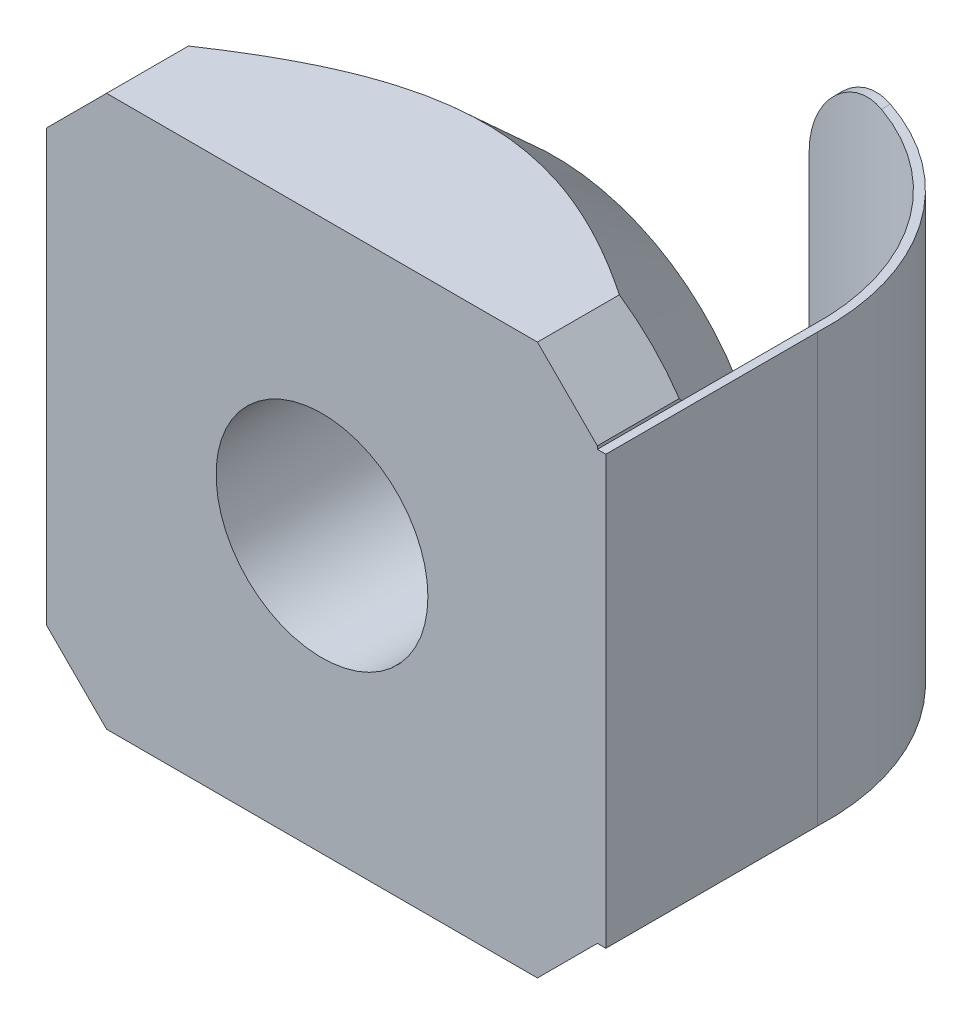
SolidWorks part; units mm, degrees
ref_plane "Front" through (0, 0, 0) normal (0, 0, 1) x (1, 0, 0)
ref_plane "Top" through (0, 0, 0) normal (0, 1, 0) x (1, 0, 0)
ref_plane "Right" through (0, 0, 0) normal (1, 0, 0) x (0, 0, -1)
imported_body "Imported1"
hole_wizard "M6x1.0 Tapped Hole1" positions "3DSketch1" profile "Sketch1" tap size "M6x1.0" standard "Ansi Metric"
sketch3d "3DSketch1"
  line L0 (-6.5, 5.0858, 0) -> (-6.5, -5.0858, 0) construction
  line L1 (5.0858, 6.5, 0) -> (-5.0858, 6.5, 0) construction
  point P0 (0, 0, 0)
  dimension "D1" = 6.5
  dimension "D2" = 6.5
sketch "Sketch1" plane through (0, 0, 0) normal (1, 0, 0) x (0, -1, 0)
  line L0 (0, 0) -> (0, 7.5022)
  line L1 (0, 7.5022) -> (2.5, 6)
  line L2 (2.5, 6) -> (2.5, 0)
  line L5 (2.5, 0) -> (0, 0)
  line L10 (0, 7.5022) -> (-2.5, 6) construction
  line L11 (0, -6.35) -> (0, 107.95) construction
  dimension "Tap Drill Dia." = 5
  dimension "Tap Drill Depth" = 6
  dimension "Drill Angle" = 118
